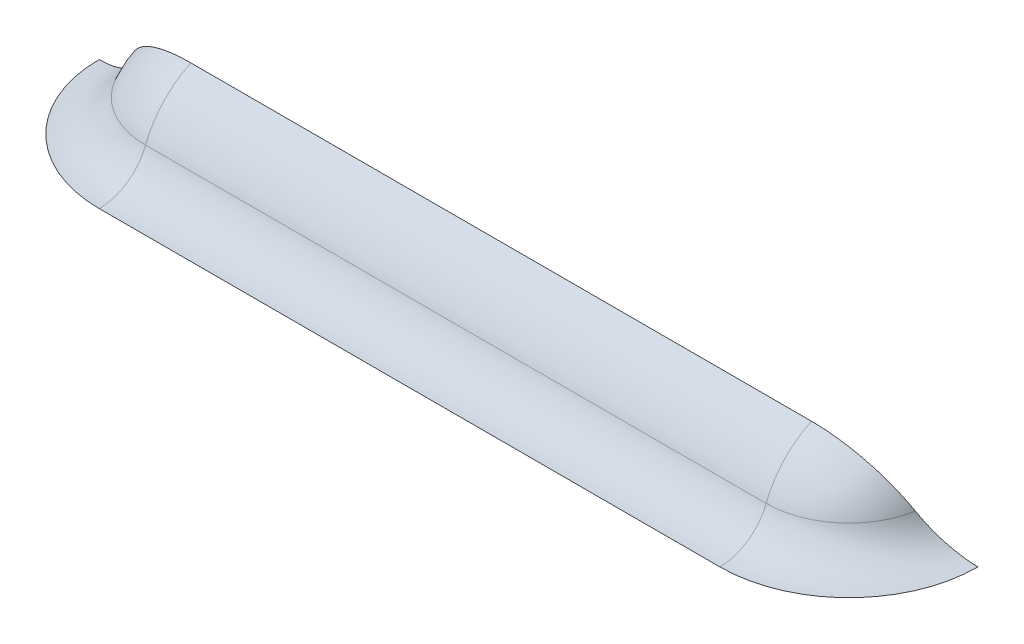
SolidWorks part; units mm, degrees
ref_plane "front" through (0, 0, 0) normal (0, 0, 1) x (1, 0, 0)
ref_plane "top" through (0, 0, 0) normal (0, 1, 0) x (1, 0, 0)
ref_plane "side" through (0, 0, 0) normal (1, 0, 0) x (0, 0, -1)
sketch "Sketch1" plane through (0, 0, 0) normal (1, 0, 0) x (0, 0, -1)
  line L0 (-25.4, 0) -> (25.4, 0)
  line L1 (-25.4, 0) -> (-25.4, 3.4642)
  line L2 (25.4, 3.4642) -> (-25.4, 3.4642)
  line L3 (25.4, 3.4642) -> (25.4, 0)
  line L4 (0, 0) -> (0, 3.4642) construction
  point P4 (0, 0)
  dimension "D1" = 50.8
  dimension "D2" = 3.4642
extrude "Base-Extrude" add sketch "Sketch1" along normal mid plane 101.6
sketch "Sketch3" plane through (0, 4.665, 2.5812) normal (1, 0, 0) x (0, 0, 1)
  line L0 (-4.547, 1.2007) -> (-4.547, -4.2437)
  line L2 (-4.547, 1.2007) -> (0.8974, 1.2007)
  line L4 (0.8974, 1.2007) -> (0.8974, 3.4642) construction
  line L5 (-27.9812, 1.2007) -> (22.8188, 1.2007) construction
  line L6 (-4.547, -4.2437) -> (-3.0249, -4.2437) construction
  line L8 (-1.8248, 13.7033) -> (-1.8248, 1.2007) construction
  arc A0 (-4.547, -4.2437) -> (0.8974, 1.2007) centre (-4.547, 1.2007) ccw
extrude "Boss-Extrude1" add sketch "Sketch3" along normal mid plane 38.1
sketch "Sketch4" plane through (-19.05, 0, 0) normal (-1, 0, 0) x (0, 0, 1)
  line L0 (-1.9658, 3.4642) -> (-1.9658, 8.9087) construction
  line L2 (-1.9658, 3.4642) -> (3.4786, 3.4642)
  line L3 (-1.9658, 8.9087) -> (-1.9658, 3.4642)
  line L4 (-1.9658, 3.4642) -> (3.4786, 3.4642)
  line L5 (-1.9658, 8.9087) -> (-1.9658, 3.4642)
  arc A1 (3.4786, 3.4642) -> (-1.9658, 8.9087) centre (-1.9658, 3.4642) ccw
  arc A2 (3.4786, 3.4642) -> (-1.9658, 8.9087) centre (-1.9658, 3.4642) ccw
  dimension "D1" = 0
revolve "Boss-Revolve1" add sketch "Sketch4" angle 90 about L0
mirror "Mirror1" about plane through (0, 0, 0) normal (1, 0, 0) of "Boss-Revolve1"
fillet "Fillet1" radius 3.048 3 edges at (0, 3.4642, 3.4786) (-22.8998, 3.4642, 1.884) (22.8998, 3.4642, 1.884)
sketch "Sketch7" plane through (0, 0, 0) normal (1, 0, 0) x (0, 0, -1)
  line L0 (1.9658, 3.4642) -> (-0.3351, 8.3986)
  line L3 (1.9658, 5.4183) -> (1.9658, 8.9087) construction
  line L4 (1.9658, 3.4642) -> (1.9658, 8.9087)
  line L5 (25.4, 3.4642) -> (-25.4, 3.4642) construction
  line L7 (1.9658, 3.4642) -> (1.9658, 8.9087)
  line L8 (-3.4786, 3.4642) -> (1.9658, 3.4642)
  arc A0 (1.9658, 8.9087) -> (-3.1159, 5.4183) centre (1.9658, 3.4642) ccw construction
  arc A2 (1.9658, 8.9087) -> (-3.4786, 3.4642) centre (1.9658, 3.4642) ccw
  arc A3 (1.9658, 8.9087) -> (-0.3351, 8.3986) centre (1.9658, 3.4642) ccw
  dimension "D1" = 25
  dimension "D2" = 0
extrude "Cut-Extrude2" cut sketch "Sketch7" against normal through all and the other way through all
sketch "Sketch5" plane through (-50.8, 0, 0) normal (-1, 0, 0) x (0, 0, 1)
  line L4 (25.4, 0) -> (25.4, 3.4642)
  line L5 (25.4, 3.4642) -> (-25.4, 3.4642)
  line L6 (-25.4, 3.4642) -> (-25.4, 0)
  line L7 (-25.4, 0) -> (25.4, 0)
  line L8 (25.4, 0) -> (25.4, 3.4642)
  line L9 (25.4, 3.4642) -> (-25.4, 3.4642)
  line L10 (-25.4, 3.4642) -> (-25.4, 0)
  line L11 (-25.4, 0) -> (25.4, 0)
  dimension "D1" = 0
extrude "Cut-Extrude1" cut sketch "Sketch5" against normal through all
sketch "Orientation sketch" plane through (0, 3.4642, 0) normal (0, -1, 0) x (1, 0, 0)
  line L2 (19.05, 5.9608) -> (-19.05, 5.9608)
  line L3 (-26.9766, -1.9658) -> (26.9766, -1.9658)
  line L4 (19.05, 5.9608) -> (-19.05, 5.9608)
  line L5 (-26.9766, -1.9658) -> (26.9766, -1.9658)
  arc A2 (26.9766, -1.9658) -> (19.05, 5.9608) centre (19.05, -1.9658) ccw
  arc A3 (-19.05, 5.9608) -> (-26.9766, -1.9658) centre (-19.05, -1.9658) ccw
  arc A4 (26.9766, -1.9658) -> (19.05, 5.9608) centre (19.05, -1.9658) ccw
  arc A5 (-19.05, 5.9608) -> (-26.9766, -1.9658) centre (-19.05, -1.9658) ccw
  dimension "D1" = 0
